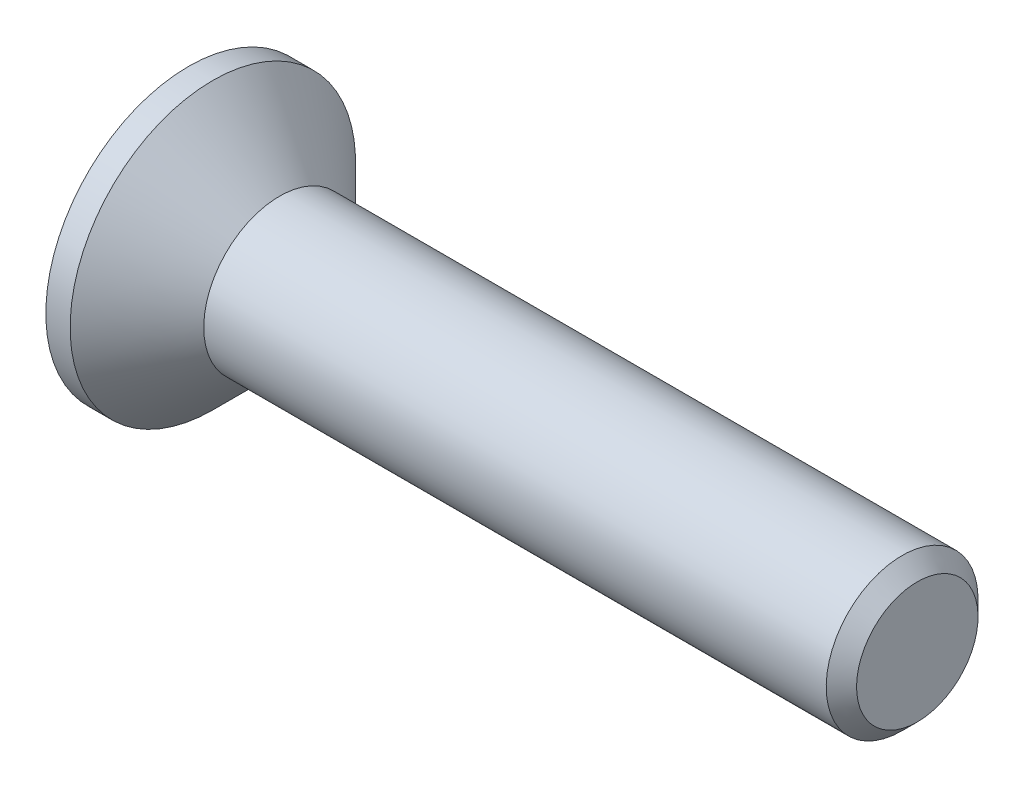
SolidWorks part; units mm, degrees
ref_plane "Front Plane" through (0, 0, 0) normal (0, 0, 1) x (1, 0, 0)
ref_plane "Top Plane" through (0, 0, 0) normal (0, 1, 0) x (1, 0, 0)
ref_plane "Right Plane" through (0, 0, 0) normal (1, 0, 0) x (0, 0, -1)
sketch "Sketch1" plane through (0, 0, 0) normal (0, 0, 1) x (1, 0, 0)
  line L1 (-1.5, 2.35) -> (-1.5, 0)
  line L2 (-1.5, 0) -> (10.5, 0)
  line L3 (10.5, 0) -> (10.5, 1.25)
  line L4 (10.5, 1.25) -> (0, 1.25)
  line L5 (-1.5, 2.35) -> (-1.1, 2.35)
  line L6 (-1.1, 2.35) -> (0, 1.25)
  dimension "D1" = 1.25
  dimension "D2" = 45
  dimension "D3" = 1.5
  dimension "D4" = 12
  dimension "D5" = 2.35
revolve "Revolve1" add sketch "Sketch1" angle 360 about L2
chamfer "Chamfer1" distance 0.25 angle 45 1 edges at (10.5, -1.25, 0)
sketch "Sketch2" plane through (-1.5, 0, 0) normal (-1, 0, 0) x (0, 0, 1)
  line L0 (-0.34, 1.35) -> (0.34, 1.35)
  line L1 (0.34, 1.35) -> (0.34, 0.34)
  line L2 (0.34, 0.34) -> (1.35, 0.34)
  line L3 (1.35, 0.34) -> (1.35, -0.34)
  line L4 (1.35, -0.34) -> (0.34, -0.34)
  line L5 (0.34, -0.34) -> (0.34, -1.35)
  line L6 (0.34, -1.35) -> (-0.34, -1.35)
  line L7 (-0.34, -1.35) -> (-0.34, -0.34)
  line L8 (-0.34, -0.34) -> (-1.35, -0.34)
  line L9 (-1.35, -0.34) -> (-1.35, 0.34)
  line L10 (-1.35, 0.34) -> (-0.34, 0.34)
  line L11 (-0.34, 0.34) -> (-0.34, 1.35)
  point P2 (0, 1.35)
  point P14 (0, -1.35)
  point P15 (1.35, 0)
  point P16 (-1.35, 0)
  dimension "D1" = 2.7
  dimension "D2" = 0.68
extrude "Cut-Extrude1" cut sketch "Sketch2" against normal blind 1.25
